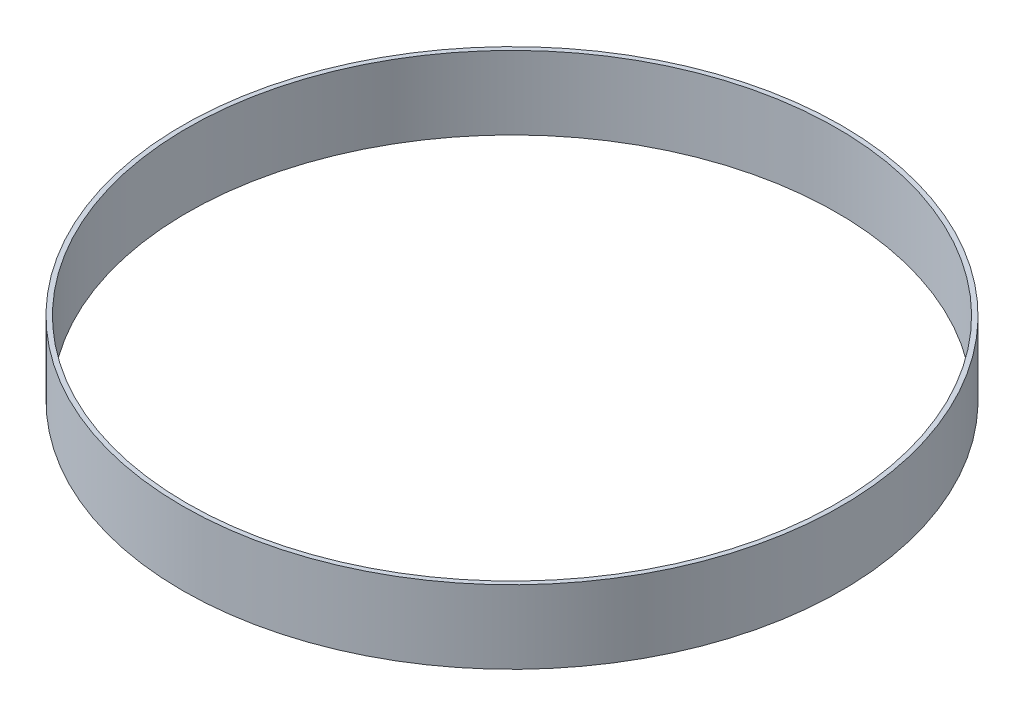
SolidWorks part; units mm, degrees
ref_plane "Front Plane" through (0, 0, 0) normal (0, 0, 1) x (1, 0, 0)
ref_plane "Top Plane" through (0, 0, 0) normal (0, 1, 0) x (1, 0, 0)
ref_plane "Right Plane" through (0, 0, 0) normal (1, 0, 0) x (0, 0, -1)
sketch "Sketch1" plane through (0, 0, 0) normal (0, 1, 0) x (1, 0, 0)
  circle A0 centre (-1.7933, 0) radius 457.2
  circle A1 centre (-1.7933, 0) radius 450.85
  dimension "D1" = 914.4
  dimension "D2" = 6.35
extrude "Extrude1" add sketch "Sketch1" along normal blind 101.6
